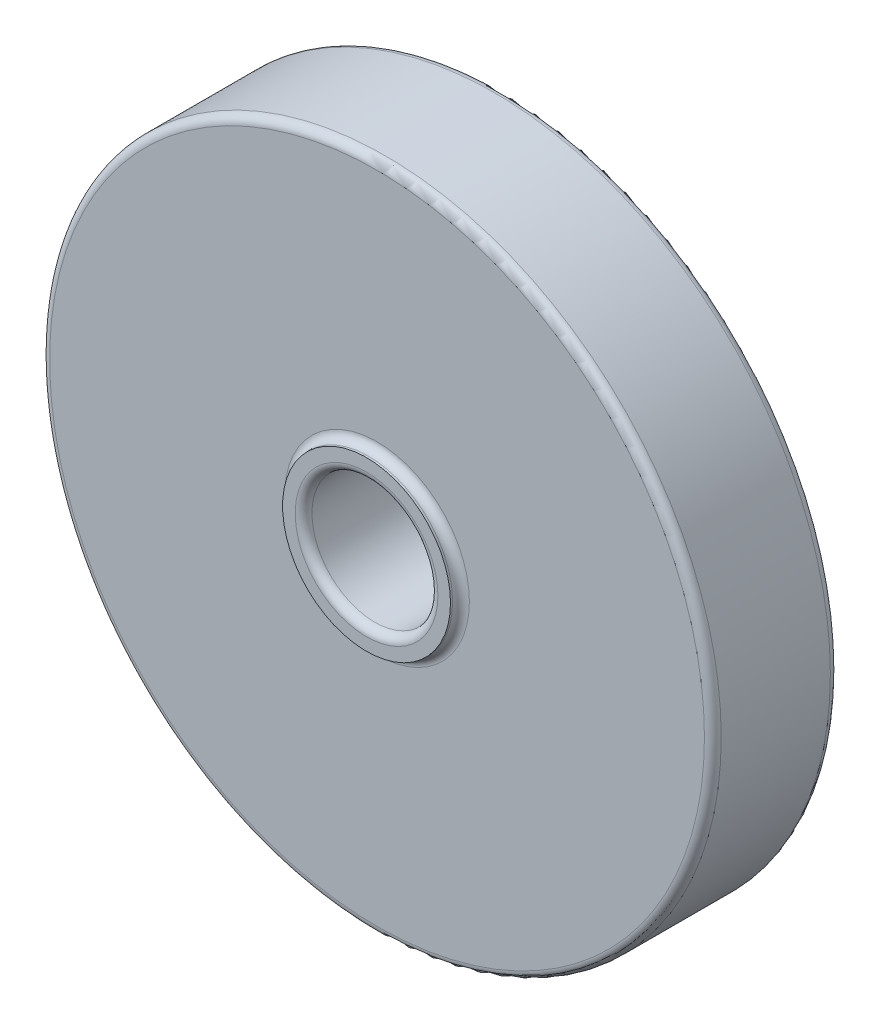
SolidWorks part; units mm, degrees
ref_plane "Face" through (0, 0, 0) normal (0, 0, 1) x (1, 0, 0)
ref_plane "Dessus" through (0, 0, 0) normal (0, 1, 0) x (1, 0, 0)
ref_plane "Droite" through (0, 0, 0) normal (1, 0, 0) x (0, 0, -1)
sketch "Esquisse1" plane through (0, 0, 0) normal (0, 0, 1) x (1, 0, 0)
  circle A0 centre (0, 0) radius 8
  circle A1 centre (0, 0) radius 1.5
  dimension "D1" = 3
  dimension "D2" = 16
extrude "Extrusion1" add sketch "Esquisse1" along normal blind 3
sketch "Esquisse2" plane through (0, 0, 3) normal (0, 0, 1) x (1, 0, 0)
  circle A0 centre (0, 0) radius 2
  circle A1 centre (0, 0) radius 1.5 construction
  circle A2 centre (0, 0) radius 1.5
  dimension "D1" = 4
extrude "Extrusion2" add sketch "Esquisse2" along normal blind 0.25
fillet "Congé1" radius 0.2
